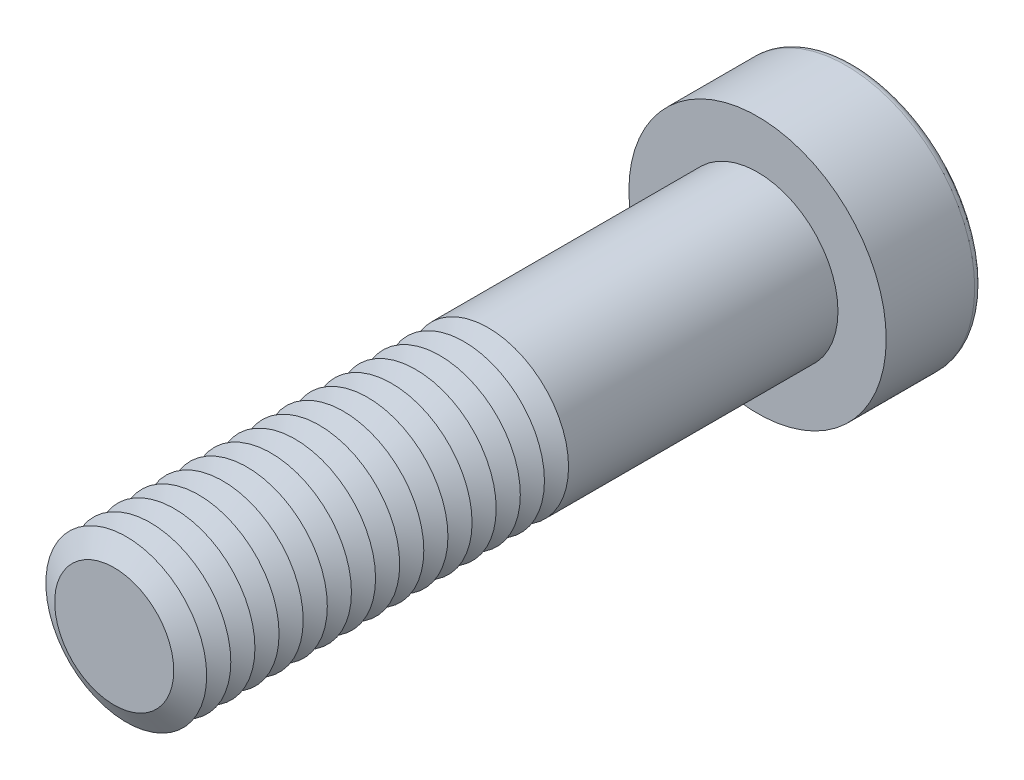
SolidWorks part; units mm, degrees
ref_plane "Front Plane" through (0, 0, 0) normal (0, 0, 1) x (1, 0, 0)
ref_plane "Top Plane" through (0, 0, 0) normal (0, 1, 0) x (1, 0, 0)
ref_plane "Right Plane" through (0, 0, 0) normal (1, 0, 0) x (0, 0, -1)
sketch "Sketch1" plane through (0, 0, 0) normal (0, 0, 1) x (1, 0, 0)
  circle A0 centre (0, 0) radius 5
  dimension "D1" = 10
extrude "Boss-Extrude1" add sketch "Sketch1" along normal blind 40
sketch "Sketch2" plane through (0, 0, 0) normal (0, 0, -1) x (-1, 0, 0)
  circle A0 centre (0, 0) radius 8
  dimension "D1" = 16
extrude "Boss-Extrude2" add sketch "Sketch2" along normal blind 6
sketch "Sketch3" plane through (0, 0, -6) normal (0, 0, -1) x (-1, 0, 0)
  line L1 (-2.0207, 3.5) -> (-4.0415, 0)
  line L2 (-4.0415, 0) -> (-2.0207, -3.5)
  line L3 (-2.0207, -3.5) -> (2.0207, -3.5)
  line L4 (2.0207, -3.5) -> (4.0415, 0)
  line L5 (4.0415, 0) -> (2.0207, 3.5)
  line L6 (2.0207, 3.5) -> (-2.0207, 3.5)
  circle A0 centre (0, 0) radius 3.5 construction
  dimension "D1" = 7
extrude "Cut-Extrude1" cut sketch "Sketch3" against normal blind 5.25
fillet "Fillet1" radius 0.5 1 edges at (-8, 0, -6)
sketch "Sketch4" plane through (0, 0, -0.75) normal (0, 0, -1) x (-1, 0, 0)
  line L0 (2.0207, -3.5) -> (4.0415, 0) construction
  circle A0 centre (0, 0) radius 3.5
extrude "Cut-Extrude2" cut sketch "Sketch4" against normal through all draft 60
sketch "Sketch5" plane through (0, 0, -6) normal (0, 0, -1) x (-1, 0, 0)
  circle A0 centre (0, 0) radius 4.0415
extrude "Cut-Extrude3" cut sketch "Sketch5" against normal through all draft 75
sketch "Sketch7" plane through (0, 0, 0) normal (1, 0, 0) x (0, 0, -1)
  line L25 (-40, 3.701) -> (-39.25, 5)
  line L26 (-40, 5) -> (-40, -5) construction
  line L27 (-39.25, 5) -> (-40.75, 5)
  line L28 (-40.75, 5) -> (-40, 3.701)
  line L29 (0, 5) -> (-40, 5) construction
  dimension "D1" = 1.5
revolve "Cut-Revolve1" cut sketch "Sketch7" angle 360 about axis through (0, 0, 40) along (0, 0, -1)
pattern_linear "LPattern1" count 16 spacing 1.5 along (0, 0, -1) of "Cut-Revolve1"
